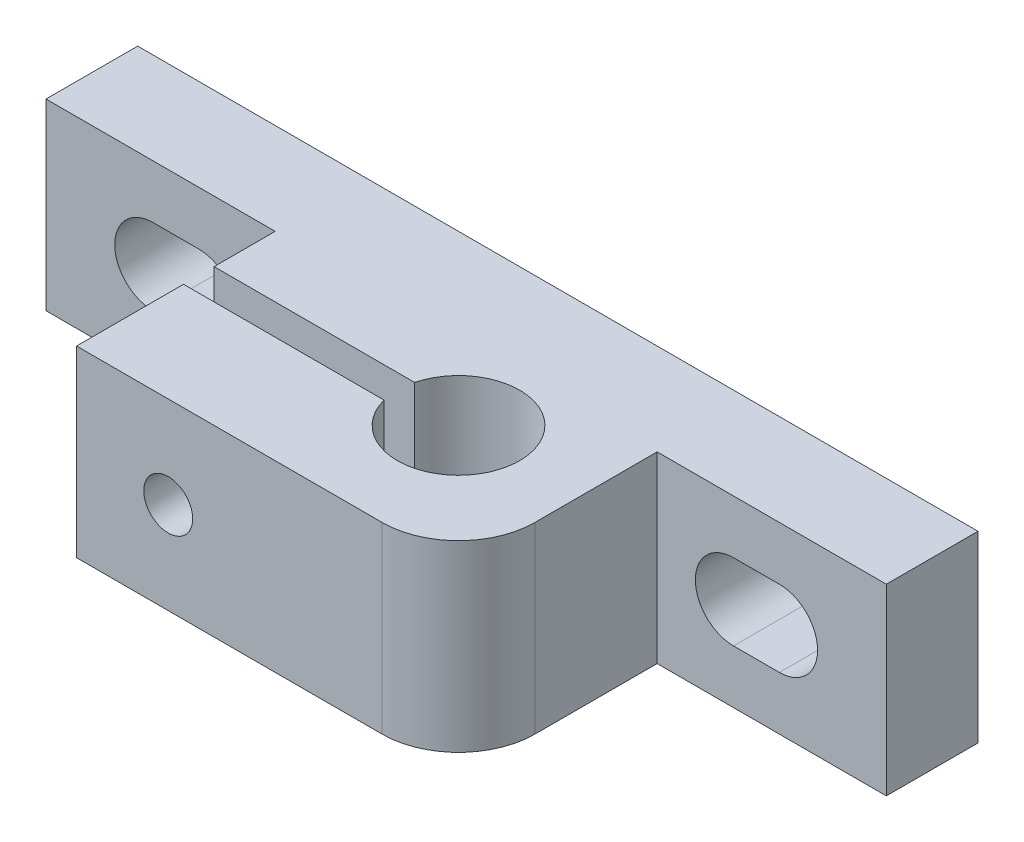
SolidWorks part; units mm, degrees
ref_plane "Front Plane" through (0, 0, 0) normal (0, 0, 1) x (1, 0, 0)
ref_plane "Top Plane" through (0, 0, 0) normal (0, 1, 0) x (1, 0, 0)
ref_plane "Right Plane" through (0, 0, 0) normal (1, 0, 0) x (0, 0, -1)
sketch "Sketch2" plane through (0, 0, 0) normal (0, 0, 1) x (1, 0, 0)
  line L0 (7, 6) -> (10, 6) construction
  line L1 (0, 0) -> (55, 0)
  line L2 (0, 0) -> (0, 12)
  line L3 (0, 12) -> (55, 12)
  line L4 (55, 0) -> (55, 12)
  line L5 (27.5, 12) -> (27.5, -3.75) construction
  line L6 (7, 8.5) -> (10, 8.5)
  line L7 (7, 3.5) -> (10, 3.5)
  line L8 (48, 6) -> (45, 6) construction
  line L9 (48, 8.5) -> (45, 8.5)
  line L10 (48, 3.5) -> (45, 3.5)
  arc A0 (7, 8.5) -> (7, 3.5) centre (7, 6) ccw
  arc A1 (48, 8.5) -> (48, 3.5) centre (48, 6) cw
  arc A2 (10, 3.5) -> (10, 8.5) centre (10, 6) ccw
  arc A3 (45, 3.5) -> (45, 8.5) centre (45, 6) cw
  point P11 (8.5, 6)
  point P16 (46.5, 6)
  dimension "D1" = 7
  dimension "D2" = 3
  dimension "D5" = 55
extrude "Boss-Extrude1" add sketch "Sketch2" along normal blind 6
sketch "Sketch3" plane through (0, 0, 6) normal (0, 0, 1) x (1, 0, 0)
  line L0 (0, 0) -> (55, 0) construction
  line L1 (15, 0) -> (40, 0)
  line L2 (15, 0) -> (15, 12)
  line L3 (15, 12) -> (40, 12)
  line L4 (40, 0) -> (40, 12)
  line L5 (55, 12) -> (0, 12) construction
  line L6 (0, 12) -> (0, 0) construction
  line L7 (55, 0) -> (55, 12) construction
  dimension "D1" = 25
  dimension "D2" = 15
  dimension "D3" = 15
extrude "Boss-Extrude2" add sketch "Sketch3" along normal blind 13
fillet "Fillet1" radius 5 1 edges at (40, 6, 19)
sketch "Sketch4" plane through (0, 0, 0) normal (0, -1, 0) x (1, 0, 0)
  line L0 (15, 19) -> (35, 19) construction
  line L1 (40, 14) -> (40, 6) construction
  line L2 (0, 0) -> (55, 0) construction
  line L3 (28.127, 12) -> (15, 12)
  line L4 (15, 19) -> (15, 6) construction
  line L5 (15, 12) -> (15, 10)
  line L6 (15, 10) -> (28.127, 10)
  circle A0 centre (32, 11) radius 4
  dimension "D1" = 8
  dimension "D5" = 8
  dimension "D7" = 11
  dimension "D2" = 8
  dimension "D3" = 11
  dimension "D4" = 1
  dimension "D6" = 1
extrude "Cut-Extrude2" cut sketch "Sketch4" against normal blind 30 contours A0 L3 L6 M4 | A0
sketch "Sketch5" plane through (0, 0, 0) normal (0, 0, -1) x (-1, 0, 0)
  line L0 (-55, 12) -> (0, 12) construction
  line L1 (-37.6724, 9.5) -> (-17.1585, 9.5)
  line L2 (-37.6724, 9.5) -> (-37.6724, 2.5)
  line L3 (-37.6724, 2.5) -> (-17.1585, 2.5)
  line L4 (-17.1585, 9.5) -> (-17.1585, 2.5)
  line L5 (0, 0) -> (-55, 0) construction
  line L6 (0, 12) -> (0, 0) construction
  dimension "D1" = 20.5139
  dimension "D2" = 2.5
  dimension "D3" = 2.5
  dimension "D4" = 17.1585
extrude "Cut-Extrude3" cut sketch "Sketch5" against normal blind 5
sketch "Sketch6" plane through (0, 0, 19) normal (0, 0, 1) x (1, 0, 0)
  line L0 (15, 12) -> (15, 0) construction
  line L1 (35, 12) -> (15, 12) construction
  line L2 (15, 0) -> (35, 0) construction
  circle A0 centre (21, 6) radius 1.6
  dimension "D1" = 6
  dimension "D2" = 6
  dimension "D3" = 6
extrude "Cut-Extrude4" cut sketch "Sketch6" against normal blind 20
sketch "Sketch7" plane through (0, 0, 5) normal (0, 0, -1) x (-1, 0, 0)
  line L1 (-17.5359, 6) -> (-19.2679, 9)
  line L2 (-19.2679, 9) -> (-22.7321, 9)
  line L3 (-22.7321, 9) -> (-24.4641, 6)
  line L4 (-24.4641, 6) -> (-22.7321, 3)
  line L5 (-22.7321, 3) -> (-19.2679, 3)
  line L6 (-19.2679, 3) -> (-17.5359, 6)
  circle A0 centre (-21, 6) radius 3 construction
extrude "Cut-Extrude5" cut sketch "Sketch7" against normal blind 3
